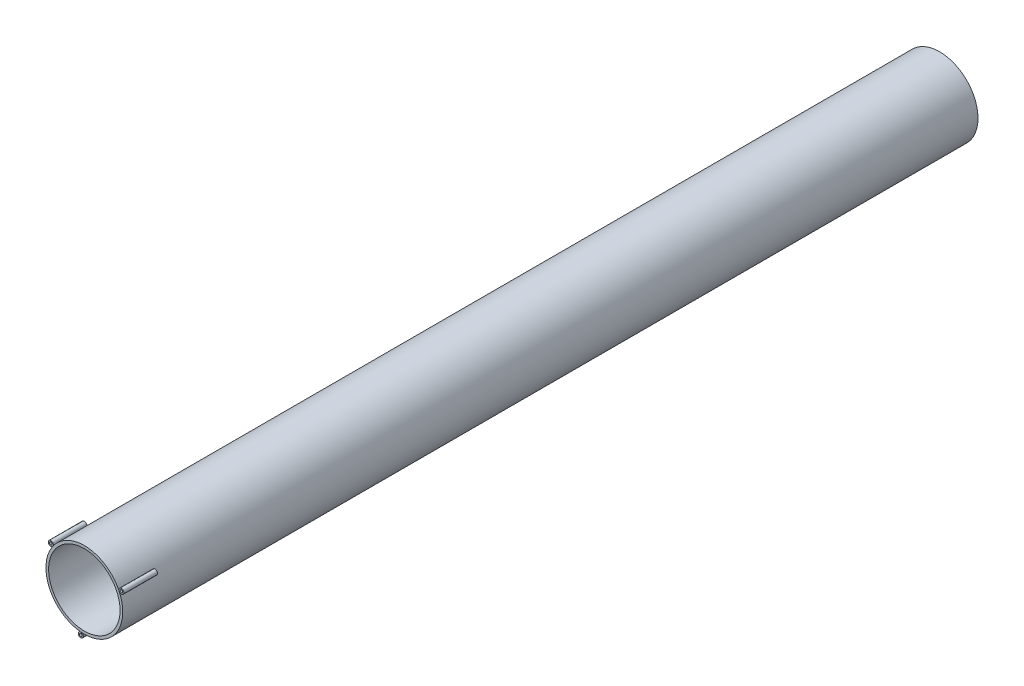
SolidWorks part; units mm, degrees
ref_plane "Front Plane" through (0, 0, 0) normal (0, 0, 1) x (1, 0, 0)
ref_plane "Top Plane" through (0, 0, 0) normal (0, 1, 0) x (1, 0, 0)
ref_plane "Right Plane" through (0, 0, 0) normal (1, 0, 0) x (0, 0, -1)
sketch "Sketch1" plane through (0, 0, 0) normal (0, 0, 1) x (1, 0, 0)
  circle A0 centre (0, 0) radius 27.051
  circle A1 centre (0, 0) radius 29.083
extrude "Extrude2" add sketch "Sketch1" along normal blind 647.7
sketch "Sketch6" plane through (0, 0, 647.7) normal (0, 0, 1) x (1, 0, 0)
  circle A0 centre (-2.6846, -30.8715) radius 1.905
  circle A1 centre (-2.6846, -30.8715) radius 1.016
  circle A2 centre (28.0778, 13.1108) radius 1.905
  circle A3 centre (28.0778, 13.1108) radius 1.016
  circle A4 centre (0, 0) radius 29.083 construction
  circle A6 centre (-25.3932, 17.7607) radius 1.905
  circle A7 centre (-25.3932, 17.7607) radius 1.016
extrude "Extrude3" add sketch "Sketch6" against normal blind 25.4
